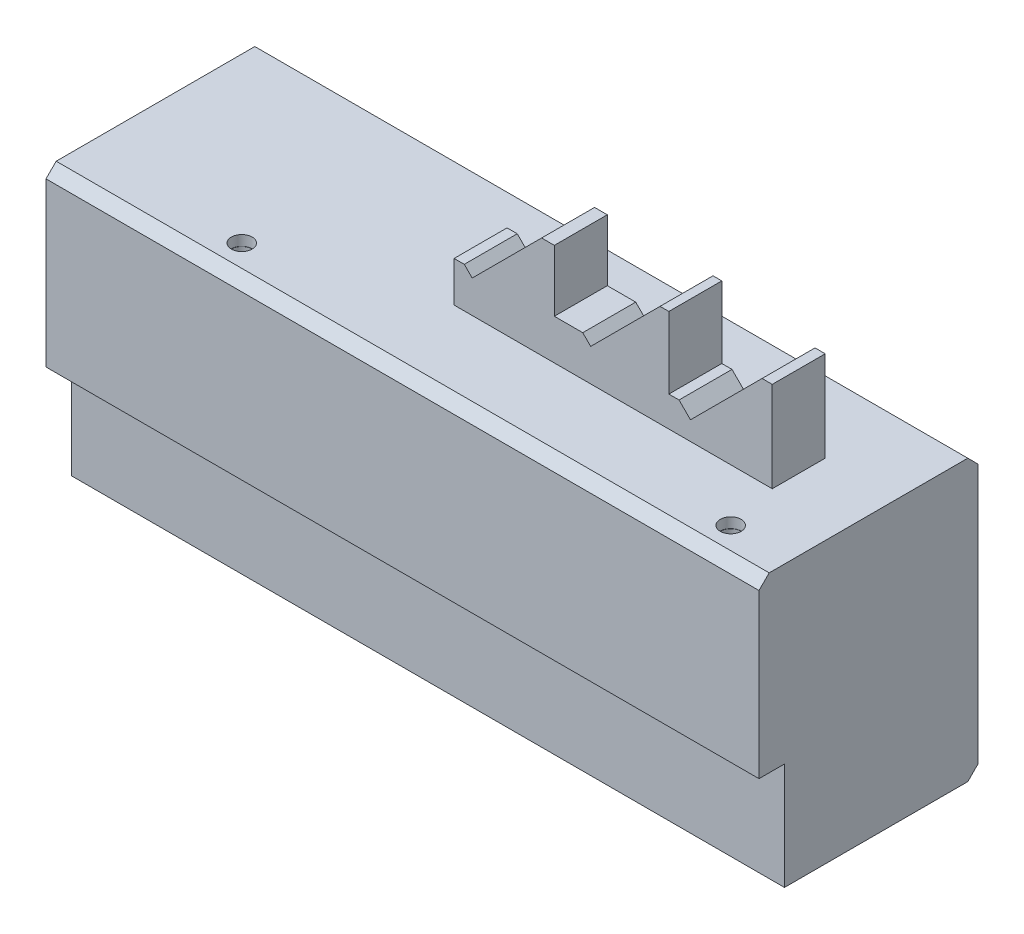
SolidWorks part; units mm, degrees
ref_plane "前视基准面" through (0, 0, 0) normal (0, 0, 1) x (1, 0, 0)
ref_plane "上视基准面" through (0, 0, 0) normal (0, 1, 0) x (1, 0, 0)
ref_plane "右视基准面" through (0, 0, 0) normal (1, 0, 0) x (0, 0, -1)
sketch "草图16" plane through (0, 0, 0) normal (0, 1, 0) x (1, 0, 0)
  line L0 (0, 18.8643) -> (0, -24.4329) construction
  line L1 (-41.831, 0) -> (66.6438, 0) construction
  line L5 (-35, -10.75) -> (35, -10.75)
  line L6 (-35, -10.75) -> (-35, 10.75)
  line L7 (-35, 10.75) -> (35, 10.75)
  line L8 (35, -10.75) -> (35, 10.75)
  line L9 (-35, -10.75) -> (35, 10.75) construction
  line L10 (-35, 10.75) -> (35, -10.75) construction
  point P9 (0, 0)
  dimension "D1" = 10.75
  dimension "D2" = 70
extrude "凸台-拉伸6" add sketch "草图16" along normal blind 2.5
sketch "草图19" plane through (0, 2.5, 0) normal (0, 1, 0) x (1, 0, 0)
  line L0 (0, 13.2444) -> (0, -15.3074) construction
  line L1 (-37.0512, 0) -> (38.6191, 0) construction
  point P5 (-31.5, 5.5)
  point P6 (-31.5, -5.5)
  dimension "D1" = 11
  dimension "D2" = 63
sketch "草图23" plane through (0, 2.5, 0) normal (0, 1, 0) x (1, 0, 0)
  line L0 (0, 10.6803) -> (0, -16.3402) construction
  line L1 (-20.8, -4) -> (18, -4)
  line L2 (-20.8, -4) -> (-20.8, 5)
  line L3 (-20.8, 5) -> (18, 5)
  line L4 (18, -4) -> (18, 5)
  line L5 (-38.181, 0) -> (69.9909, 0) construction
  line L7 (35, -10.75) -> (35, 10.75) construction
  point P0 (0, 0)
  dimension "D1" = 9
  dimension "D2" = 38.8
  dimension "D3" = 17
  dimension "D4" = 4
extrude "凸台-拉伸7" [suppressed] add sketch "草图23" along normal blind 15
sketch "草图28" [suppressed] plane through (0, 0, 0) normal (0, 0, 1) x (1, 0, 0)
  line L1 (18, 17.5) -> (18, 2.5) construction
  line L4 (16.35, 7.46) -> (17.1278, 8.2378)
  line L6 (12.7438, 11.0662) -> (16.35, 7.46)
  line L7 (12.7438, 11.0662) -> (11.9404, 11.0662)
  line L8 (17.1278, 8.2378) -> (18, 8.2378)
  line L9 (18, 8.2378) -> (18, 18.2344)
  line L10 (18, 18.2344) -> (11.9404, 18.2344)
  line L11 (-35, 2.5) -> (35, 2.5) construction
  line L12 (11.9404, 11.0662) -> (11.9404, 18.2344)
  line L13 (35, 2.5) -> (35, 0) construction
  dimension "D1" = 4.96
  dimension "D2" = 45
  dimension "D3" = 5.1
  dimension "D4" = 18.65
  dimension "D5" = 1.1
  dimension "D7" = 0.8034
  dimension "D8" = 9.9966
extrude "切除-拉伸2" [suppressed] cut sketch "草图28" against normal mid plane 14 contours L10 L12 L7 L6 L4 L8 L9
pattern_linear "阵列(线性)1" [suppressed] count 4 spacing 11 count 4 spacing 1.7
sketch "草图29" [suppressed] plane through (0, 0, 4) normal (0, 0, 1) x (1, 0, 0)
  line L0 (-10.0596, 17.5) -> (-10.0596, 14.4662) construction
  line L1 (-15, 17.5) -> (-10.0596, 17.5)
  line L2 (-15, 17.5) -> (-15, 13.3378)
  line L3 (7, 17.5) -> (11.9404, 17.5) construction
  line L4 (-10.0596, 17.5) -> (-10.0596, 13.3378)
  line L5 (0.9404, 17.5) -> (0.9404, 12.7662) construction
  line L6 (-4, 17.5) -> (0.9404, 17.5)
  line L7 (-4, 17.5) -> (-4, 11.6212)
  line L8 (-15, 17.5) -> (-15, 13.3378) construction
  line L9 (0.9404, 17.5) -> (0.9404, 11.433)
  line L10 (7, 17.5) -> (11.9404, 17.5)
  line L11 (7, 17.5) -> (7, 9.9378)
  line L12 (-15, 13.3378) -> (-10.0596, 13.3378)
  line L13 (11.9404, 17.5) -> (11.9404, 9.9378)
  line L14 (11.9404, 17.5) -> (11.9404, 11.0662) construction
  line L15 (-4, 17.5) -> (0.9404, 17.5) construction
  line L16 (-15, 17.5) -> (-10.0596, 17.5) construction
  line L18 (-4, 11.6212) -> (0.9404, 11.433)
  line L19 (7, 9.9378) -> (11.9404, 9.9378)
  line L22 (-15, 13.3378) -> (-15.8722, 13.3378) construction
  line L23 (-4, 11.6378) -> (-4.8722, 11.6378) construction
  line L24 (7, 9.9378) -> (6.1278, 9.9378) construction
  point P12 (-4.4361, 11.6378)
extrude "切除-拉伸3" [suppressed] cut sketch "草图29" against normal through all
sketch "草图31" [suppressed] plane through (0, 0, 4) normal (0, 0, 1) x (1, 0, 0)
  line L1 (-20.8, 16.1662) -> (-20.98, 16.1662)
  line L2 (-20.98, 16.1662) -> (-20.98, 2.5)
  line L3 (-20.98, 16.1662) -> (-20.98, 2.5)
  line L4 (-20.8, 2.5) -> (-20.98, 2.5)
  line L6 (-20.8, 16.1662) -> (-20.8, 2.5) construction
  line L7 (-20.8, 16.1662) -> (-20.8, 2.5)
  dimension "D1" = 0.18
extrude "凸台-拉伸8" [suppressed] add sketch "草图31" against normal up to surface (9 mm away)
sketch "草图33" [suppressed] plane through (0, 0, 4) normal (0, 0, 1) x (1, 0, 0)
  line L0 (-20.98, 16.1662) -> (-20.98, 2.5) construction
  line L2 (-20.5, 2.5001) -> (-21.5, 2.5)
  line L4 (-20.5, 17.5232) -> (-20.5, 2.5001)
  line L5 (-35, 2.5) -> (35, 2.5) construction
  line L6 (-21.5, 2.5) -> (-21.5, 17.5232)
  line L7 (-21.5, 17.5232) -> (-20.5, 17.5232)
  dimension "D1" = 0.52
  dimension "D2" = 1
extrude "切除-拉伸5" [suppressed] cut sketch "草图33" against normal through all
other "移动面1" [suppressed] parameters "D1"=0.5
sketch "草图38" plane through (0, 0, 0) normal (0, -1, 0) x (1, 0, 0)
  line L1 (-35, 10.75) -> (35, 10.75)
  line L2 (-35, 10.75) -> (-35, -10.75)
  line L3 (-35, -10.75) -> (35, -10.75)
  line L4 (35, 10.75) -> (35, -10.75)
extrude "凸台-拉伸9" add sketch "草图38" along normal blind 25
sketch "草图34" [suppressed] plane through (0, 16.1662, 0) normal (0, 1, 0) x (1, 0, 0)
  line L0 (-18.3797, 6.4988) -> (-18.3797, -4) construction
  line L2 (-20.98, -4) -> (18, -4) construction
  line L3 (35, 8.25) -> (-35, 8.25) construction
  line L6 (-18.3797, -0.5) -> (-18.3797, 2) construction
  line L7 (-19.5797, -0.5) -> (-19.5797, 2)
  line L8 (-17.1797, -0.5) -> (-17.1797, 2)
  line L9 (-20.98, 5) -> (-20.98, -4) construction
  arc A0 (-19.5797, -0.5) -> (-17.1797, -0.5) centre (-18.3797, -0.5) ccw
  arc A1 (-17.1797, 2) -> (-19.5797, 2) centre (-18.3797, 2) ccw
  point P14 (-18.3797, 0.75)
  dimension "D2" = 1.2
  dimension "D1" = 2.5
  dimension "D3" = 7.5
  dimension "D4" = 2.6003
extrude "切除-拉伸6" [suppressed] cut sketch "草图34" against normal blind 26
sketch "草图35" plane through (-35, 0, 0) normal (1, 0, 0) x (0, 0, -1)
  line L0 (-10.75, -11.25) -> (10.75, -11.25) construction
  line L1 (-10.75, 2.5) -> (-10.75, -25) construction
  line L2 (10.75, 2.5) -> (10.75, -25) construction
  line L3 (0, 20.9837) -> (0, -15.0802) construction
  point P8 (0, -11.25)
hole_wizard "G1/8 螺纹孔2" positions "草图36" profile "草图37" tap size "G1/8" standard "GB"
sketch "草图36" plane through (-35, 0, 0) normal (-1, 0, 0) x (0, 0, 1)
  point P0 (0, -11.25)
sketch "草图37" plane through (-35, -11.25, 0) normal (0, 1, 0) x (0, 0, 1)
  line L0 (0, 0) -> (0, 64.6438)
  line L1 (0, 64.6438) -> (4.4, 62)
  line L2 (4.4, 62) -> (4.4, 0)
  line L5 (4.4, 0) -> (0, 0)
  line L10 (0, 64.6438) -> (-4.4, 62) construction
  line L11 (0, -6.35) -> (0, 107.95) construction
  dimension "螺纹孔钻头直径" = 8.8
  dimension "螺纹孔钻头深度" = 62
  dimension "导头角度" = 118
sketch "草图40" plane through (0, -25, -11.75) normal (0, 1, 0) x (1, 0, 0)
  line L0 (-35, -11.75) -> (35, -11.75) construction
  line L1 (-35, -1) -> (-35, -22.5) construction
  line L2 (35, -22.5) -> (35, -1) construction
  line L3 (0, 8.0818) -> (0, -34.0718) construction
  circle A0 centre (-25, -11.75) radius 1.5
  circle A1 centre (25, -11.75) radius 1.5
  dimension "D1" = 50
hole_wizard "M4 螺纹孔1" positions "3D草图2" profile "草图42" tap size "M4" standard "GB"
sketch3d "3D草图2"
  point P0 (-25, -25, 0)
  point P3 (25, -25, 0)
sketch "草图42" plane through (-25, -25, 0) normal (1, 0, 0) x (0, 0, -1)
  line L0 (0, 0) -> (0, 5.4914)
  line L1 (0, 5.4914) -> (1.65, 4.5)
  line L2 (1.65, 4.5) -> (1.65, 0.375)
  line L3 (1.65, 0.375) -> (2.025, 0)
  line L5 (2.025, 0) -> (0, 0)
  line L6 (-1.65, 0.375) -> (-2.025, 0) construction
  line L10 (0, 5.4914) -> (-1.65, 4.5) construction
  line L11 (0, -6.35) -> (0, 107.95) construction
  dimension "螺纹孔钻头直径" = 3.3
  dimension "螺纹孔钻头深度" = 4.5
  dimension "近端锥形沉头孔直径" = 4.05
  dimension "近端锥形沉头孔角度" = 90
  dimension "导头角度" = 118
other "移动面2" [suppressed] parameters "D1"=1
chamfer "倒角2" distance 1 angle 45 4 edges at (0, -25, 10.75) (0, -25, -10.75) (0, 2.5, 10.75) (0, 2.5, -10.75)
sketch "草图47" [suppressed] plane through (0, 0, 4) normal (0, 0, 1) x (1, 0, 0)
  line L0 (17.1278, 8.2378) -> (13.5923, 11.7734) construction
  line L1 (6.1278, 9.9378) -> (2.5923, 13.4734) construction
  circle A0 centre (15.6414, 9.7242) radius 1.0853
  circle A1 centre (4.3601, 11.7056) radius 1.0853
  circle A2 centre (-6.6399, 13.4056) radius 1.0853
  circle A3 centre (-17.6399, 15.1056) radius 1.0853
surface "曲面-拉伸1" [suppressed] sketch "草图47" parameters "D1"=10
sketch "草图48" plane through (0, 2.5, 0) normal (0, 1, 0) x (1, 0, 0)
  circle A0 centre (29.0704, -7.6) radius 1.025
  circle A3 centre (-18.9296, -7.6) radius 1.025
  dimension "D3" = 48
sketch "草图49" plane through (-35, 0, 0) normal (-1, 0, 0) x (0, 0, 1)
  line L0 (9.75, -25) -> (-9.75, -25) construction
  line L1 (8.25, -25) -> (10.75, -25)
  line L2 (8.25, -25) -> (8.25, -14.5)
  line L3 (8.25, -14.5) -> (10.75, -14.5)
  line L4 (10.75, -25) -> (10.75, -14.5)
  line L5 (10.75, 1.5) -> (10.75, -24) construction
  dimension "D1" = 2.5
  dimension "D2" = 10.5
extrude "切除-拉伸7" cut sketch "草图49" against normal through all
extrude "切除-拉伸8" cut sketch "草图48" against normal blind 1
sketch "草图50" plane through (0, 2.5, 0) normal (0, 1, 0) x (1, 0, 0)
  circle A0 centre (-18.9296, -7.6) radius 1
  circle A1 centre (29.0704, -7.6) radius 1
  dimension "D1" = 2
  dimension "D2" = 2
extrude "切除-拉伸9" cut sketch "草图50" against normal blind 3.2
sketch "草图51" plane through (0, 2.5, 0) normal (0, 1, 0) x (1, 0, 0)
  line L0 (35, -10.75) -> (-35, -10.75) construction
  line L1 (-8, 5.75) -> (28, 5.75)
  line L2 (-8, 5.75) -> (-8, -5.75)
  line L3 (-8, -5.75) -> (28, -5.75)
  line L4 (28, 5.75) -> (28, -5.75)
  line L5 (-35, 10.75) -> (35, 10.75) construction
  line L6 (-35, 9.75) -> (-35, -9.75) construction
  line L7 (35, -9.75) -> (35, 9.75) construction
  dimension "D1" = 5
  dimension "D2" = 5
  dimension "D3" = 27
  dimension "D4" = 7
extrude "凸台-拉伸10" add sketch "草图51" along normal blind 10
sketch "草图52" plane through (0, 0, -5.75) normal (0, 0, -1) x (-1, 0, 0)
  line L0 (2.2352, 6.4645) -> (8, 6.4645)
  line L1 (8, 12.5) -> (8, 2.5) construction
  line L2 (8, 6.4645) -> (8, 12.5)
  line L3 (8, 12.5) -> (-5.356, 12.5)
  line L4 (-28, 12.5) -> (8, 12.5) construction
  line L5 (-28.1228, 12.5) -> (-19.9722, 4.3495)
  line L6 (-5.356, 12.5) -> (1.4573, 5.6866)
  line L7 (1.4573, 5.6866) -> (2.2352, 6.4645)
  line L9 (-16.9834, 12.5) -> (-10.1741, 5.6906)
  line L10 (-19.9722, 4.3495) -> (-18.8485, 5.4732)
  line L12 (-28.1228, 12.5) -> (-17.8485, 12.5)
  line L13 (-10.1741, 5.6906) -> (-9.3962, 6.4685)
  line L14 (-9.3962, 6.4685) -> (-6.6071, 6.4685)
  line L15 (-18.8485, 5.4732) -> (-17.8485, 5.4732)
  line L16 (-6.6071, 6.4685) -> (-6.6071, 12.5)
  line L17 (-17.8485, 5.4732) -> (-17.8485, 12.5)
  line L18 (-16.9834, 12.5) -> (-6.6071, 12.5)
  dimension "D1" = 1
extrude "切除-拉伸10" cut sketch "草图52" against normal through all
sketch "草图54" plane through (0, 6.4645, 0) normal (0, 1, 0) x (1, 0, 0)
  line L0 (-8, -5.75) -> (28, -5.75) construction
  line L1 (-8, 5.75) -> (-5, 5.75)
  line L2 (-8, 5.75) -> (-8, -5.75)
  line L3 (-8, -5.75) -> (-5, -5.75)
  line L4 (-5, 5.75) -> (-5, -5.75)
  dimension "D1" = 3
extrude "切除-拉伸12" cut sketch "草图54" against normal up to surface (3.9645 mm away)
sketch "草图57" plane through (0, 0, 5.75) normal (0, 0, 1) x (1, 0, 0)
  line L20 (28, 2.5) -> (28, 12.3772)
  line L21 (19.9722, 4.3495) -> (18.8485, 5.4732)
  line L23 (28, 12.3772) -> (19.9722, 4.3495)
  line L24 (19.9722, 4.3495) -> (18.8485, 5.4732)
  line L25 (18.8485, 5.4732) -> (17.8485, 5.4732)
  line L26 (18.8485, 5.4732) -> (17.8485, 5.4732)
  line L27 (17.8485, 5.4732) -> (17.8485, 12.5)
  line L28 (17.8485, 5.4732) -> (17.8485, 12.5)
  line L29 (17.8485, 12.5) -> (16.9834, 12.5)
  line L30 (6.6071, 6.4685) -> (6.6071, 12.5)
  line L31 (6.6071, 12.5) -> (5.356, 12.5)
  line L32 (17.8485, 12.5) -> (16.9834, 12.5)
  line L33 (-1.4573, 5.6866) -> (-2.2352, 6.4645)
  line L34 (-2.2352, 6.4645) -> (-5, 6.4645)
  line L35 (-5, 6.4645) -> (-5, 2.5)
  line L36 (-5, 2.5) -> (28, 2.5)
  line L39 (28, 2.5) -> (28, 12.3772)
  line L40 (16.9834, 12.5) -> (10.1741, 5.6906)
  line L42 (28, 12.3772) -> (19.9722, 4.3495)
  line L43 (16.9834, 12.5) -> (10.1741, 5.6906)
  line L44 (10.1741, 5.6906) -> (9.3962, 6.4685)
  line L45 (10.1741, 5.6906) -> (9.3962, 6.4685)
  line L46 (9.3962, 6.4685) -> (6.6071, 6.4685)
  line L47 (9.3962, 6.4685) -> (6.6071, 6.4685)
  line L48 (5.356, 12.5) -> (-1.4573, 5.6866)
  line L49 (6.6071, 6.4685) -> (6.6071, 12.5)
  line L50 (6.6071, 12.5) -> (5.356, 12.5)
  line L51 (5.356, 12.5) -> (-1.4573, 5.6866)
  line L52 (-1.4573, 5.6866) -> (-2.2352, 6.4645)
  line L53 (-2.2352, 6.4645) -> (-5, 6.4645)
  line L54 (-5, 6.4645) -> (-5, 2.5)
  line L55 (-5, 2.5) -> (28, 2.5)
  dimension "D1" = 0
extrude "切除-拉伸15" cut sketch "草图57" against normal blind 1
sketch "草图58" plane through (0, 0, 4.75) normal (0, 0, 1) x (1, 0, 0)
  line L14 (6.6071, 6.4685) -> (6.6071, 12.5)
  line L15 (6.6071, 12.5) -> (5.356, 12.5)
  line L16 (5.356, 12.5) -> (-1.4573, 5.6866)
  line L17 (-1.4573, 5.6866) -> (-2.2352, 6.4645)
  line L18 (-2.2352, 6.4645) -> (-5, 6.4645)
  line L19 (-5, 6.4645) -> (-5, 2.5)
  line L20 (-5, 2.5) -> (28, 2.5)
  line L23 (28, 2.5) -> (28, 12.3772)
  line L24 (5.356, 12.5) -> (-1.4573, 5.6866)
  line L26 (28, 12.3772) -> (19.9722, 4.3495)
  line L27 (19.9722, 4.3495) -> (18.8485, 5.4732)
  line L28 (6.6071, 6.4685) -> (6.6071, 12.5)
  line L29 (6.6071, 12.5) -> (5.356, 12.5)
  line L30 (19.9722, 4.3495) -> (18.8485, 5.4732)
  line L31 (-1.4573, 5.6866) -> (-2.2352, 6.4645)
  line L32 (-2.2352, 6.4645) -> (-5, 6.4645)
  line L33 (-5, 6.4645) -> (-5, 2.5)
  line L34 (-5, 2.5) -> (28, 2.5)
  line L37 (28, 2.5) -> (28, 12.3772)
  line L38 (18.8485, 5.4732) -> (17.8485, 5.4732)
  line L40 (28, 12.3772) -> (19.9722, 4.3495)
  line L41 (18.8485, 5.4732) -> (17.8485, 5.4732)
  line L47 (17.8485, 5.4732) -> (17.8485, 12.5)
  line L48 (17.8485, 5.4732) -> (17.8485, 12.5)
  line L49 (17.8485, 12.5) -> (16.9834, 12.5)
  line L50 (17.8485, 12.5) -> (16.9834, 12.5)
  line L51 (16.9834, 12.5) -> (10.1741, 5.6906)
  line L52 (16.9834, 12.5) -> (10.1741, 5.6906)
  line L53 (10.1741, 5.6906) -> (9.3962, 6.4685)
  line L54 (10.1741, 5.6906) -> (9.3962, 6.4685)
  line L55 (9.3962, 6.4685) -> (6.6071, 6.4685)
  line L56 (9.3962, 6.4685) -> (6.6071, 6.4685)
  dimension "D1" = 0
extrude "切除-拉伸16" cut sketch "草图58" against normal blind 1.5
sketch "草图59" plane through (0, 0, 3.25) normal (0, 0, 1) x (1, 0, 0)
  line L19 (9.3962, 6.4685) -> (6.6071, 6.4685)
  line L20 (6.6071, 6.4685) -> (6.6071, 12.5)
  line L21 (6.6071, 12.5) -> (5.356, 12.5)
  line L22 (5.356, 12.5) -> (-1.4573, 5.6866)
  line L23 (-1.4573, 5.6866) -> (-2.2352, 6.4645)
  line L24 (-2.2352, 6.4645) -> (-5, 6.4645)
  line L25 (-5, 6.4645) -> (-5, 2.5)
  line L26 (-5, 2.5) -> (28, 2.5)
  line L29 (28, 2.5) -> (28, 12.3772)
  line L31 (28, 12.3772) -> (19.9722, 4.3495)
  line L32 (19.9722, 4.3495) -> (18.8485, 5.4732)
  line L33 (18.8485, 5.4732) -> (17.8485, 5.4732)
  line L34 (17.8485, 5.4732) -> (17.8485, 12.5)
  line L35 (17.8485, 12.5) -> (16.9834, 12.5)
  line L36 (16.9834, 12.5) -> (10.1741, 5.6906)
  line L37 (10.1741, 5.6906) -> (9.3962, 6.4685)
  line L38 (9.3962, 6.4685) -> (6.6071, 6.4685)
  line L39 (6.6071, 6.4685) -> (6.6071, 12.5)
  line L40 (6.6071, 12.5) -> (5.356, 12.5)
  line L41 (5.356, 12.5) -> (-1.4573, 5.6866)
  line L42 (-1.4573, 5.6866) -> (-2.2352, 6.4645)
  line L43 (-2.2352, 6.4645) -> (-5, 6.4645)
  line L44 (-5, 6.4645) -> (-5, 2.5)
  line L45 (-5, 2.5) -> (28, 2.5)
  line L48 (28, 2.5) -> (28, 12.3772)
  line L50 (28, 12.3772) -> (19.9722, 4.3495)
  line L51 (19.9722, 4.3495) -> (18.8485, 5.4732)
  line L52 (18.8485, 5.4732) -> (17.8485, 5.4732)
  line L53 (17.8485, 5.4732) -> (17.8485, 12.5)
  line L54 (17.8485, 12.5) -> (16.9834, 12.5)
  line L55 (16.9834, 12.5) -> (10.1741, 5.6906)
  line L56 (10.1741, 5.6906) -> (9.3962, 6.4685)
  dimension "D1" = 0
extrude "切除-拉伸17" cut sketch "草图59" against normal blind 0.8
sketch "草图60" plane through (0, 0, -5.75) normal (0, 0, -1) x (-1, 0, 0)
  line L0 (-28, 12.3772) -> (-28, 11.3772)
  line L1 (-28, 12.3772) -> (-28, 2.5) construction
  line L2 (-28, 11.3772) -> (-27, 11.3772)
  line L3 (-28, 12.3772) -> (-19.9722, 4.3495) construction
  line L4 (-27, 11.3772) -> (-28, 12.3772)
  dimension "D1" = 1
extrude "切除-拉伸18" cut sketch "草图60" against normal through all
sketch "草图61" plane through (0, 0, -5.75) normal (0, 0, -1) x (-1, 0, 0)
  line L17 (-19.9722, 4.3495) -> (-27, 11.3772)
  line L18 (-27, 11.3772) -> (-28, 11.3772)
  line L19 (-28, 11.3772) -> (-28, 2.5)
  line L20 (-28, 2.5) -> (5, 2.5)
  line L21 (5, 2.5) -> (5, 6.4645)
  line L22 (5, 6.4645) -> (2.2352, 6.4645)
  line L23 (2.2352, 6.4645) -> (1.4573, 5.6866)
  line L24 (1.4573, 5.6866) -> (-5.356, 12.5)
  line L25 (-5.356, 12.5) -> (-6.6071, 12.5)
  line L26 (-6.6071, 12.5) -> (-6.6071, 6.4685)
  line L27 (-6.6071, 6.4685) -> (-9.3962, 6.4685)
  line L28 (-9.3962, 6.4685) -> (-10.1741, 5.6906)
  line L29 (-10.1741, 5.6906) -> (-16.9834, 12.5)
  line L30 (-16.9834, 12.5) -> (-17.8485, 12.5)
  line L31 (-17.8485, 12.5) -> (-17.8485, 5.4732)
  line L32 (-17.8485, 5.4732) -> (-18.8485, 5.4732)
  line L33 (-18.8485, 5.4732) -> (-19.9722, 4.3495)
  line L34 (-19.9722, 4.3495) -> (-27, 11.3772)
  line L35 (-27, 11.3772) -> (-28, 11.3772)
  line L36 (-28, 11.3772) -> (-28, 2.5)
  line L37 (-28, 2.5) -> (5, 2.5)
  line L38 (5, 2.5) -> (5, 6.4645)
  line L39 (5, 6.4645) -> (2.2352, 6.4645)
  line L40 (2.2352, 6.4645) -> (1.4573, 5.6866)
  line L41 (1.4573, 5.6866) -> (-5.356, 12.5)
  line L42 (-5.356, 12.5) -> (-6.6071, 12.5)
  line L43 (-6.6071, 12.5) -> (-6.6071, 6.4685)
  line L44 (-6.6071, 6.4685) -> (-9.3962, 6.4685)
  line L45 (-9.3962, 6.4685) -> (-10.1741, 5.6906)
  line L46 (-10.1741, 5.6906) -> (-16.9834, 12.5)
  line L47 (-16.9834, 12.5) -> (-17.8485, 12.5)
  line L48 (-17.8485, 12.5) -> (-17.8485, 5.4732)
  line L49 (-17.8485, 5.4732) -> (-18.8485, 5.4732)
  line L50 (-18.8485, 5.4732) -> (-19.9722, 4.3495)
  dimension "D1" = 0
extrude "切除-拉伸19" cut sketch "草图61" against normal blind 3
sketch "草图62" plane through (0, 6.4645, 0) normal (0, 1, 0) x (1, 0, 0)
  line L0 (-5, -2.45) -> (28, -2.45) construction
  line L1 (-5, 2.75) -> (-3.2352, 2.75)
  line L2 (-5, 2.75) -> (-5, -2.45)
  line L3 (-5, -2.45) -> (-3.2352, -2.45)
  line L4 (-3.2352, 2.75) -> (-3.2352, -2.45)
  line L5 (-2.2352, -2.45) -> (-2.2352, 2.75) construction
  dimension "D1" = 1
extrude "切除-拉伸20" cut sketch "草图62" against normal up to surface (3.9645 mm away)
sketch "草图63" plane through (0, 12.5, 0) normal (0, 1, 0) x (1, 0, 0)
  line L0 (0.4493, -0.65) -> (3.4493, -0.65) construction
  line L1 (0.4493, 0.35) -> (3.4493, 0.35)
  line L2 (0.4493, -1.65) -> (3.4493, -1.65)
  line L3 (1.9493, 2.75) -> (1.9493, -5.5335) construction
  line L4 (-1.4573, 2.75) -> (5.356, 2.75) construction
  line L5 (5.356, -2.45) -> (-1.4573, -2.45) construction
  line L6 (12.0793, -0.65) -> (15.0793, -0.65) construction
  line L7 (12.0793, 0.35) -> (15.0793, 0.35)
  line L8 (12.0793, -1.65) -> (15.0793, -1.65)
  line L9 (22.0793, -0.65) -> (25.0793, -0.65) construction
  line L10 (22.0793, 0.35) -> (25.0793, 0.35)
  line L11 (22.0793, -1.65) -> (25.0793, -1.65)
  arc A0 (0.4493, 0.35) -> (0.4493, -1.65) centre (0.4493, -0.65) ccw
  arc A1 (3.4493, -1.65) -> (3.4493, 0.35) centre (3.4493, -0.65) ccw
  arc A2 (12.0793, 0.35) -> (12.0793, -1.65) centre (12.0793, -0.65) ccw
  arc A3 (15.0793, -1.65) -> (15.0793, 0.35) centre (15.0793, -0.65) ccw
  arc A4 (22.0793, 0.35) -> (22.0793, -1.65) centre (22.0793, -0.65) ccw
  arc A5 (25.0793, -1.65) -> (25.0793, 0.35) centre (25.0793, -0.65) ccw
  point P2 (1.9493, -0.65)
  point P17 (13.5793, -0.65)
  point P24 (23.5793, -0.65)
  dimension "D2" = 1
  dimension "D3" = 1.5
  dimension "D1" = 0.8
  dimension "D5" = 11.63
  dimension "D4" = 2
  dimension "D6" = 2
extrude "切除-拉伸21" cut sketch "草图63" against normal blind 23
